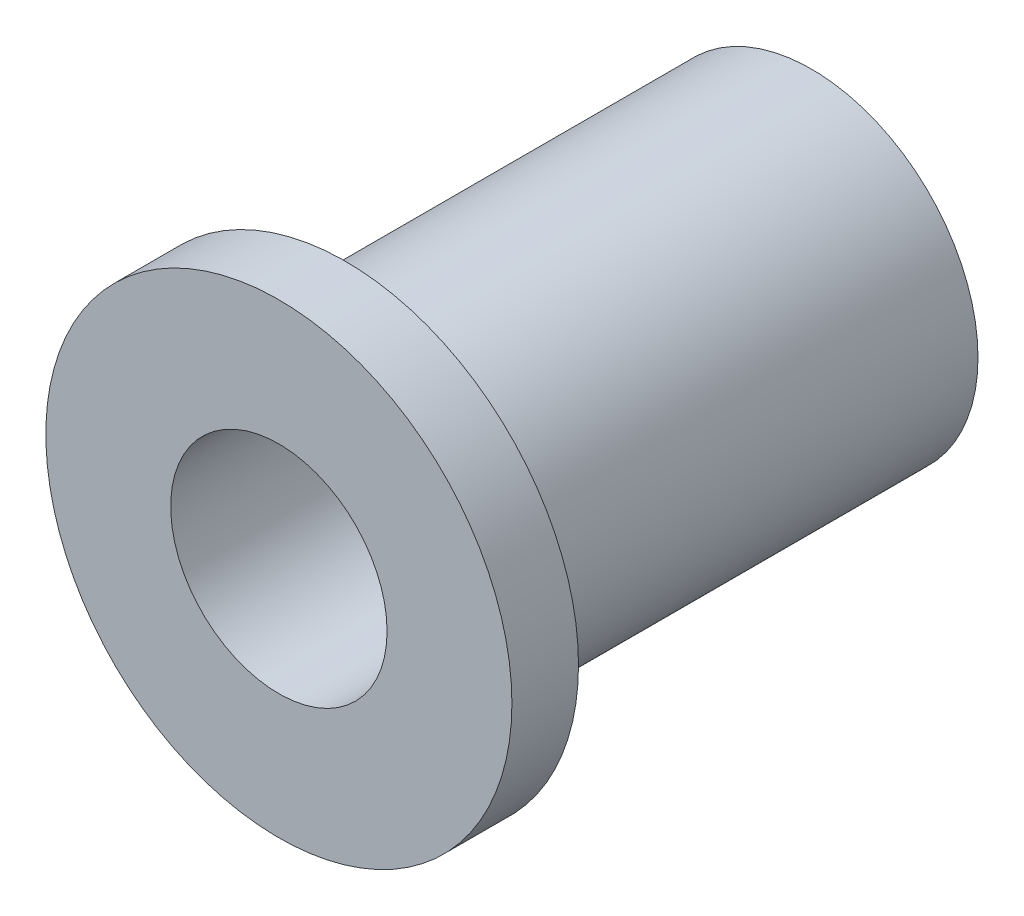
SolidWorks part; units mm, degrees
ref_plane "Plan de face" through (0, 0, 0) normal (0, 0, 1) x (1, 0, 0)
ref_plane "Plan de dessus" through (0, 0, 0) normal (0, 1, 0) x (1, 0, 0)
ref_plane "Plan de droite" through (0, 0, 0) normal (1, 0, 0) x (0, 0, -1)
sketch "Esquisse1" plane through (0, 0, 0) normal (1, 0, 0) x (0, 0, -1)
  line L0 (0, 3.25) -> (16, 3.25)
  line L1 (16, 3.25) -> (16, 5)
  line L2 (16, 5) -> (2, 5)
  line L3 (2, 5) -> (2, 7)
  line L4 (2, 7) -> (0, 7)
  line L5 (0, 7) -> (0, 3.25)
  line L6 (0, 0) -> (13.9673, 0) construction
  dimension "D1" = 6.5
  dimension "D2" = 10
  dimension "D3" = 14
  dimension "D4" = 2
  dimension "D5" = 16
revolve "Révolution1" add sketch "Esquisse1" angle 360 about L6
